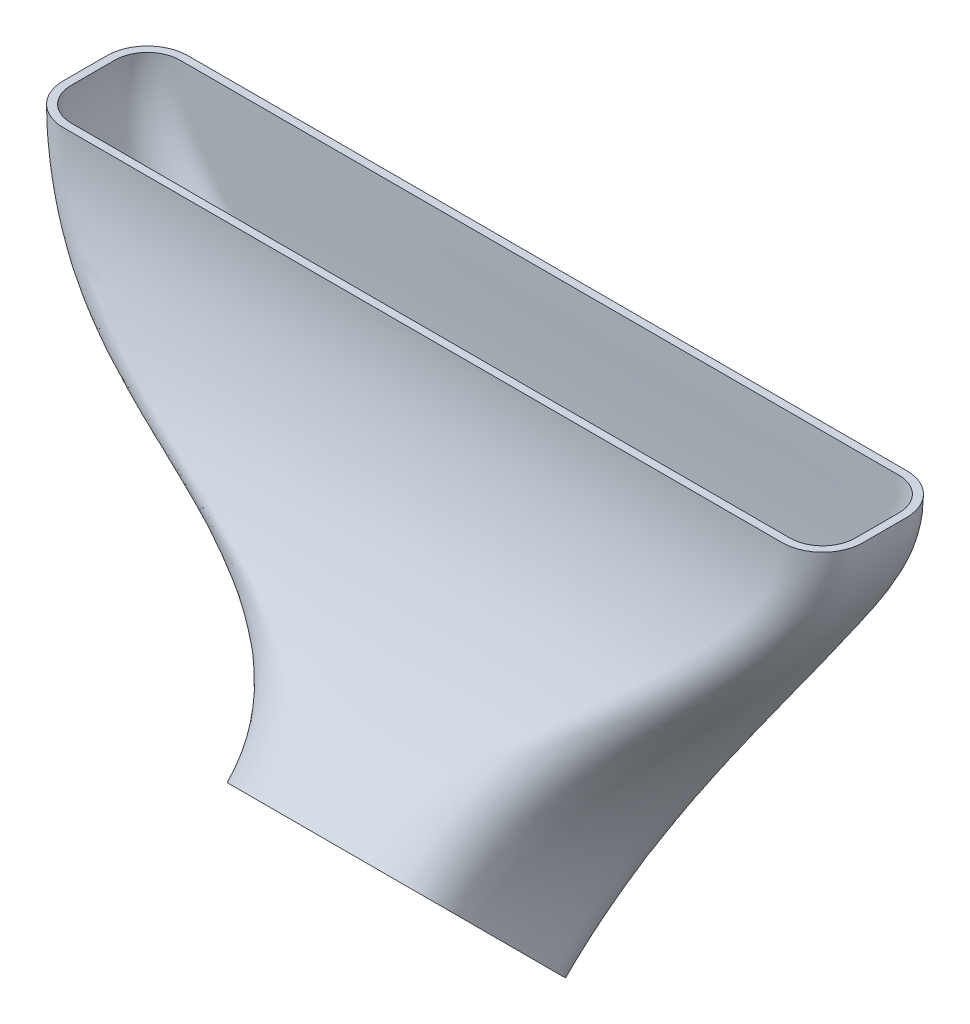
SolidWorks part; units mm, degrees
ref_plane "Front Plane" through (0, 0, 0) normal (0, 0, 1) x (1, 0, 0)
ref_plane "Top Plane" through (0, 0, 0) normal (0, 1, 0) x (1, 0, 0)
ref_plane "Right Plane" through (0, 0, 0) normal (1, 0, 0) x (0, 0, -1)
sketch3d "3DSketch1"
  line L0 (0, 0, 0) -> (0, -69.85, 0) construction
  line L1 (0, -69.85, 0) -> (0, -114.7513, 44.9013) construction
  line L2 (0, 0, -15.875) -> (0, 0, 15.875) construction
  line L3 (-104.775, 0, 15.875) -> (104.775, 0, 15.875)
  line L4 (-114.3, 0, 6.35) -> (-114.3, 0, -6.35)
  line L5 (-104.775, 0, -15.875) -> (104.775, 0, -15.875)
  line L6 (114.3, 0, 6.35) -> (114.3, 0, -6.35)
  line L7 (0, -31.75, -15.875) -> (0, -31.75, 22.225) construction
  line L8 (-88.9, -31.75, 22.225) -> (88.9, -31.75, 22.225)
  line L9 (-101.6, -31.75, 9.525) -> (-101.6, -31.75, -3.175)
  line L10 (-88.9, -31.75, -15.875) -> (88.9, -31.75, -15.875)
  line L11 (101.6, -31.75, 9.525) -> (101.6, -31.75, -3.175)
  line L12 (0, -114.7513, 44.9013) -> (19.05, -114.7513, 44.9013) construction
  line L13 (3.175, -92.3006, 67.3519) -> (34.925, -92.3006, 67.3519)
  line L14 (-12.7, -103.526, 56.1266) -> (-12.7, -125.9766, 33.676)
  line L15 (3.175, -137.2019, 22.4506) -> (34.925, -137.2019, 22.4506)
  line L16 (50.8, -103.526, 56.1266) -> (50.8, -125.9766, 33.676)
  arc A0 (104.775, 0, -15.875) -> (114.3, 0, -6.35) centre (104.775, 0, -6.35) ccw
  arc A1 (-114.3, 0, -6.35) -> (-104.775, 0, -15.875) centre (-104.775, 0, -6.35) ccw
  arc A2 (-104.775, 0, 15.875) -> (-114.3, 0, 6.35) centre (-104.775, 0, 6.35) ccw
  arc A3 (104.775, 0, 15.875) -> (114.3, 0, 6.35) centre (104.775, 0, 6.35) ccw
  arc A4 (88.9, -31.75, 22.225) -> (101.6, -31.75, 9.525) centre (88.9, -31.75, 9.525) ccw
  arc A5 (-88.9, -31.75, 22.225) -> (-101.6, -31.75, 9.525) centre (-88.9, -31.75, 9.525) ccw
  arc A6 (-101.6, -31.75, -3.175) -> (-88.9, -31.75, -15.875) centre (-88.9, -31.75, -3.175) ccw
  arc A7 (88.9, -31.75, -15.875) -> (101.6, -31.75, -3.175) centre (88.9, -31.75, -3.175) ccw
  circle A8 centre (19.05, -114.7513, 44.9013) radius 31.75 construction
  arc A9 (-12.7, -125.9766, 33.676) -> (3.175, -137.2019, 22.4506) centre (3.175, -125.9766, 33.676) ccw
  arc A10 (3.175, -92.3006, 67.3519) -> (-12.7, -103.526, 56.1266) centre (3.175, -103.526, 56.1266) ccw
  arc A11 (34.925, -92.3006, 67.3519) -> (50.8, -103.526, 56.1266) centre (34.925, -103.526, 56.1266) ccw
  arc A12 (34.925, -137.2019, 22.4506) -> (50.8, -125.9766, 33.676) centre (34.925, -125.9766, 33.676) ccw
  point P10 (114.3, 0, -15.875)
  point P11 (104.775, -9.525, -6.35)
  point P14 (-114.3, 0, -15.875)
  point P15 (-104.775, -9.525, -6.35)
  point P18 (-114.3, 0, 15.875)
  point P19 (-104.775, -9.525, 6.35)
  point P22 (114.3, 0, 15.875)
  point P23 (104.775, 9.525, 6.35)
  point P32 (101.6, -31.75, 22.225)
  point P33 (88.9, -19.05, 9.525)
  point P36 (-101.6, -31.75, 22.225)
  point P37 (-88.9, -44.45, 9.525)
  point P40 (-101.6, -31.75, -15.875)
  point P41 (-88.9, -44.45, -3.175)
  point P44 (101.6, -31.75, -15.875)
  point P45 (88.9, -44.45, -3.175)
  point P54 (19.05, -137.2019, 67.3519)
  point P57 (-12.7, -137.2019, 22.4506)
  point P58 (3.175, -137.2019, 44.9013)
  point P61 (-12.7, -92.3006, 67.3519)
  point P62 (3.175, -114.7513, 67.3519)
  point P65 (50.8, -92.3006, 67.3519)
  point P66 (34.925, -92.3006, 44.9013)
  point P69 (50.8, -137.2019, 22.4506)
  point P70 (34.925, -137.2019, 44.9013)
  dimension "D4" = 9.525
  dimension "D8" = 12.7
  dimension "D11" = 63.5
  dimension "D12" = 15.875
  dimension "D13" = 19.05
  dimension "D1" = 69.85
  dimension "D2" = 63.5
  dimension "D3" = 135
  dimension "D5" = 228.6
  dimension "D6" = 31.75
  dimension "D7" = 31.75
  dimension "D9" = 203.2
  dimension "D10" = 38.1
loft "Loft-Thin1" add parameters "D1"=2.286
